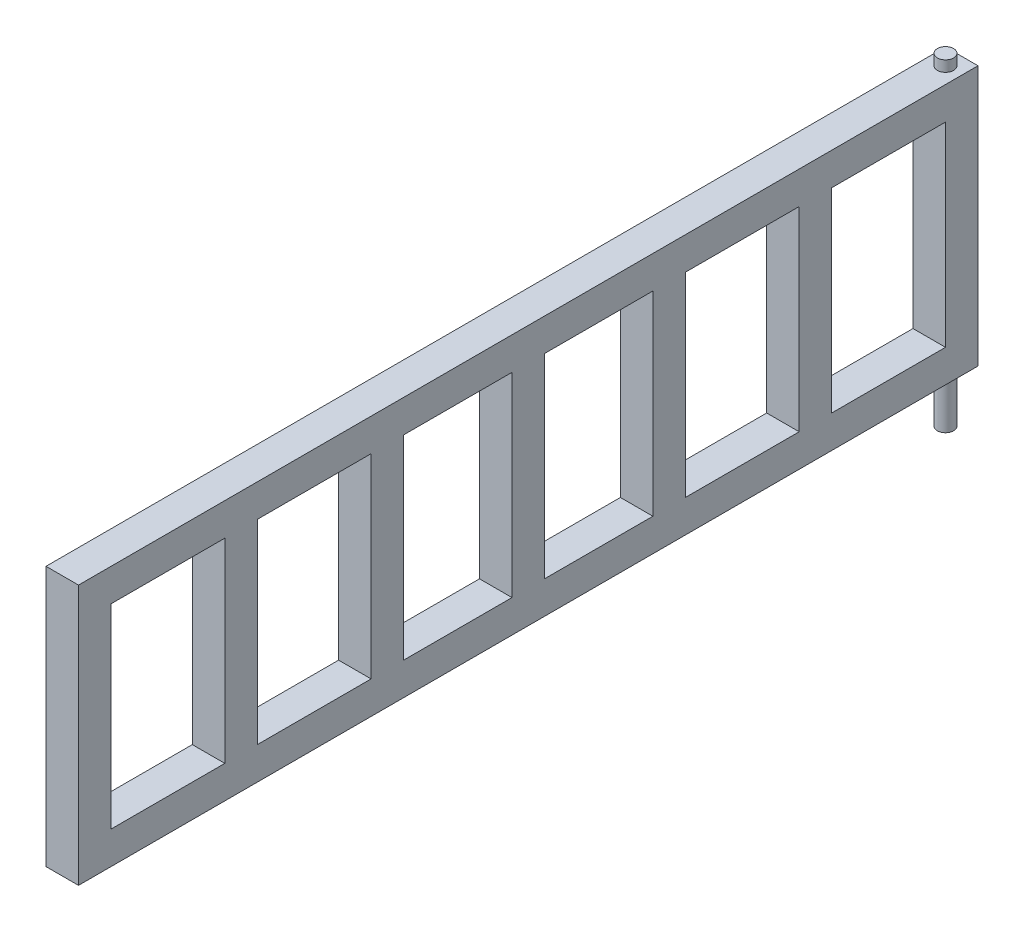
SolidWorks part; units mm, degrees
ref_plane "Plan1" through (0, 0, 0) normal (0, 0, 1) x (1, 0, 0)
ref_plane "Plan2" through (0, 0, 0) normal (0, 1, 0) x (1, 0, 0)
ref_plane "Plan3" through (0, 0, 0) normal (1, 0, 0) x (0, 0, -1)
sketch "Esquisse1" plane through (0, 0, 0) normal (0, 0, 1) x (1, 0, 0)
  line L1 (0, 0) -> (30, 0)
  line L2 (0, 0) -> (0, -30)
  line L3 (0, -30) -> (30, -30)
  line L4 (30, 0) -> (30, -30)
  dimension "D1" = 30
  dimension "D2" = 30
extrude "Base-Extrusion" add sketch "Esquisse1" along normal blind 830
sketch "Esquisse2" plane through (0, 0, 0) normal (0, 1, 0) x (-1, 0, 0)
  line L1 (0, 0) -> (-30, 0)
  line L2 (0, 0) -> (0, 30)
  line L3 (0, 30) -> (-30, 30)
  line L4 (-30, 0) -> (-30, 30)
  dimension "D1" = 30
  dimension "D2" = 30
extrude "Boss.-Extru.1" add sketch "Esquisse2" along normal blind 180
sketch "Esquisse3" plane through (0, 0, 0) normal (0, 1, 0) x (-1, 0, 0)
  line L1 (0, 830) -> (-30, 830)
  line L2 (0, 830) -> (0, 800)
  line L3 (0, 800) -> (-30, 800)
  line L4 (-30, 830) -> (-30, 800)
  dimension "D1" = 30
  dimension "D2" = 30
extrude "Boss.-Extru.2" add sketch "Esquisse3" along normal blind 180
sketch "Esquisse4" plane through (0, 180, 0) normal (0, 1, 0) x (-1, 0, 0)
  line L1 (0, 830) -> (-30, 830)
  line L2 (0, 830) -> (0, 0)
  line L3 (0, 0) -> (-30, 0)
  line L4 (-30, 830) -> (-30, 0)
extrude "Boss.-Extru.3" add sketch "Esquisse4" along normal blind 30
sketch "Esquisse5" plane through (0, 0, 0) normal (0, 1, 0) x (-1, 0, 0)
  line L0 (0, 800) -> (0, 30) construction
  line L1 (0, 665) -> (-30, 665)
  line L2 (0, 665) -> (0, 695)
  line L3 (0, 695) -> (-30, 695)
  line L4 (-30, 665) -> (-30, 695)
  dimension "D1" = 30
  dimension "D2" = 30
  dimension "D3" = 105
extrude "Boss.-Extru.4" add sketch "Esquisse5" along normal blind 180
sketch "Esquisse6" plane through (0, 0, 0) normal (0, 1, 0) x (-1, 0, 0)
  line L0 (0, 665) -> (0, 30) construction
  line L1 (0, 135) -> (-30, 135)
  line L2 (0, 135) -> (0, 165)
  line L3 (0, 165) -> (-30, 165)
  line L4 (-30, 135) -> (-30, 165)
  line L5 (0, 30) -> (-30, 30) construction
  dimension "D1" = 30
  dimension "D2" = 30
  dimension "D3" = 105
extrude "Boss.-Extru.5" add sketch "Esquisse6" along normal blind 180
sketch "Esquisse7" plane through (0, 0, 0) normal (0, 1, 0) x (-1, 0, 0)
  line L0 (0, 665) -> (0, 165) construction
  line L1 (0, 270) -> (-30, 270)
  line L2 (0, 270) -> (0, 300)
  line L3 (0, 300) -> (-30, 300)
  line L4 (-30, 270) -> (-30, 300)
  line L5 (0, 165) -> (-30, 165) construction
  dimension "D1" = 30
  dimension "D2" = 30
  dimension "D3" = 105
extrude "Boss.-Extru.6" add sketch "Esquisse7" along normal blind 180
sketch "Esquisse8" plane through (0, 0, 0) normal (0, 1, 0) x (-1, 0, 0)
  line L0 (0, 665) -> (0, 300) construction
  line L1 (0, 430) -> (-30, 430)
  line L2 (0, 430) -> (0, 400)
  line L3 (0, 400) -> (-30, 400)
  line L4 (-30, 430) -> (-30, 400)
  line L5 (0, 300) -> (-30, 300) construction
  dimension "D1" = 30
  dimension "D2" = 30
  dimension "D3" = 100
extrude "Boss.-Extru.7" add sketch "Esquisse8" along normal blind 180
sketch "Esquisse9" plane through (0, 0, 0) normal (0, 1, 0) x (-1, 0, 0)
  line L0 (0, 665) -> (0, 430) construction
  line L1 (0, 560) -> (-30, 560)
  line L2 (0, 560) -> (0, 530)
  line L3 (0, 530) -> (-30, 530)
  line L4 (-30, 560) -> (-30, 530)
  line L5 (-30, 665) -> (-30, 430) construction
  line L6 (-30, 665) -> (0, 665) construction
  dimension "D1" = 30
  dimension "D2" = 105
extrude "Boss.-Extru.8" add sketch "Esquisse9" along normal blind 180
sketch "Esquisse12" plane through (0, 210, 0) normal (0, 1, 0) x (-1, 0, 0)
  line L0 (-30, 0) -> (0, 0) construction
  circle A0 centre (-15, 15) radius 7.5
  dimension "D1" = 15
  dimension "D2" = 15
  dimension "D3" = 15
extrude "Boss.-Extru.11" add sketch "Esquisse12" along normal blind 10
sketch "Esquisse13" plane through (0, -30, 0) normal (0, -1, 0) x (1, 0, 0)
  circle A0 centre (15, 15) radius 7.5
  circle A1 centre (15, 15) radius 7.5 construction
  dimension "D1" = 15
extrude "Boss.-Extru.12" add sketch "Esquisse13" along normal blind 48
